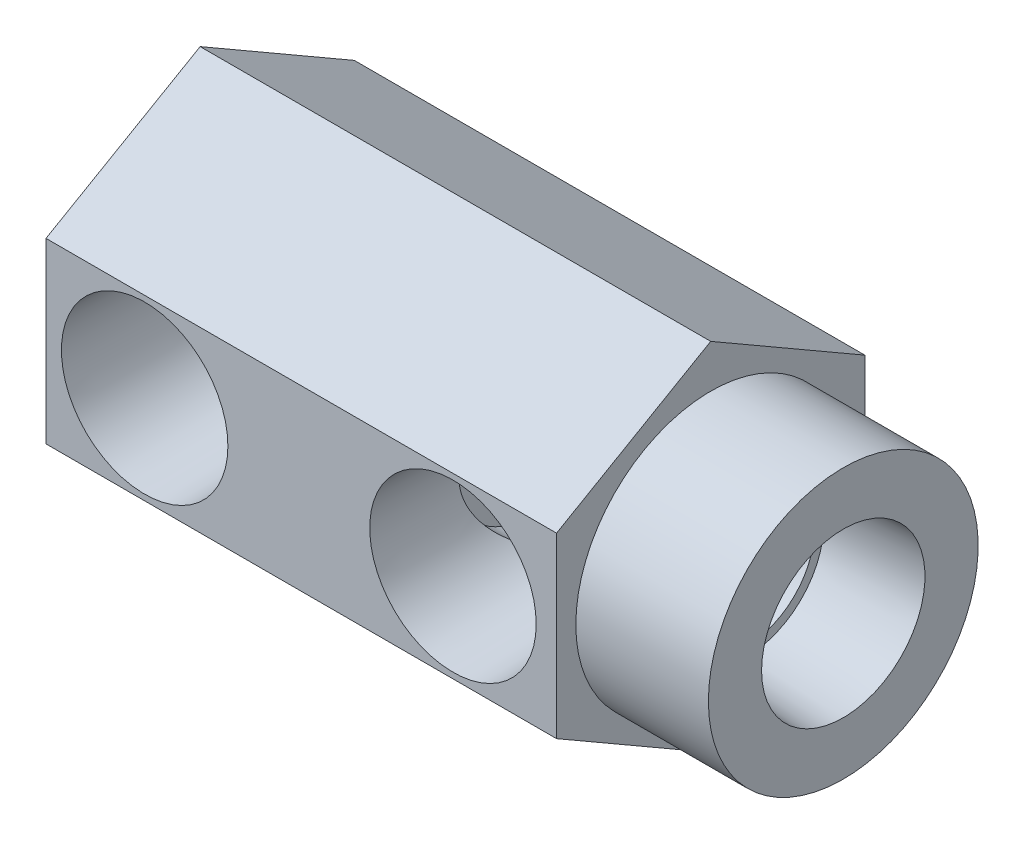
SolidWorks part; units mm, degrees
ref_plane "Front Plane" through (0, 0, 0) normal (0, 0, 1) x (1, 0, 0)
ref_plane "Top Plane" through (0, 0, 0) normal (0, 1, 0) x (1, 0, 0)
ref_plane "Right Plane" through (0, 0, 0) normal (1, 0, 0) x (0, 0, -1)
sketch "Sketch1" plane through (0, 0, 0) normal (1, 0, 0) x (0, 0, -1)
  line L0 (0, 16.1312) -> (0, -16.1312) construction
  line L1 (-12.7, -7.3323) -> (0, -14.6647)
  line L2 (0, -14.6647) -> (12.7, -7.3323)
  line L3 (12.7, -7.3323) -> (12.7, 7.3323)
  line L4 (12.7, 7.3323) -> (0, 14.6647)
  line L5 (0, 14.6647) -> (-12.7, 7.3323)
  line L6 (-12.7, 7.3323) -> (-12.7, -7.3323)
  circle A0 centre (0, 0) radius 12.7 construction
  dimension "D1" = 25.4
extrude "Boss-Extrude1" add sketch "Sketch1" along normal blind 42.0624 separate body
sketch "Sketch2" plane through (0, 0, 0) normal (1, 0, 0) x (0, 0, -1)
  circle A1 centre (0, 0) radius 11.1125
  dimension "D1" = 22.225
extrude "Boss-Extrude2" add sketch "Sketch2" along normal blind 52.9844
hole_wizard "1/4 (0.25) Diameter Hole1" positions "Sketch4" profile "Sketch3" hole size "1/4" standard "Ansi Inch"
sketch "Sketch4" plane through (52.9844, 0, 0) normal (1, 0, 0) x (0, 0, -1)
  circle A0 centre (0, 0) radius 11.1125 construction
  point P0 (0, 0)
sketch "Sketch3" plane through (52.9844, 0, 0) normal (0, 1, 0) x (0, 0, -1)
  line L0 (0, 0) -> (0, 33.6577)
  line L1 (0, 33.6577) -> (3.175, 31.75)
  line L2 (3.175, 31.75) -> (3.175, 0)
  line L5 (3.175, 0) -> (0, 0)
  line L10 (0, 33.6577) -> (-3.175, 31.75) construction
  line L11 (0, -6.35) -> (0, 107.95) construction
  dimension "Hole Dia." = 6.35
  dimension "Hole Depth" = 31.75
  dimension "Drill Angle" = 118
hole_wizard "7/32 (0.21875) Diameter Hole1" positions "Sketch6" profile "Sketch5" hole size "7/32" standard "Ansi Inch"
sketch "Sketch6" plane through (52.9844, 0, 0) normal (1, 0, 0) x (0, 0, -1)
  circle A0 centre (0, 0) radius 11.1125 construction
  point P0 (0, 0)
sketch "Sketch5" plane through (52.9844, 0, 0) normal (0, 1, 0) x (0, 0, -1)
  line L0 (0, 0) -> (0, 46.1193)
  line L1 (0, 46.1193) -> (2.7781, 44.45)
  line L2 (2.7781, 44.45) -> (2.7781, 0)
  line L5 (2.7781, 0) -> (0, 0)
  line L10 (0, 46.1193) -> (-2.7781, 44.45) construction
  line L11 (0, -6.35) -> (0, 107.95) construction
  dimension "Hole Dia." = 5.5562
  dimension "Hole Depth" = 44.45
  dimension "Drill Angle" = 118
hole_wizard "1/4 NPT Tapped Hole1" positions "Sketch8" profile "Sketch7" size "1/4" standard "Ansi Inch"
sketch "Sketch8" plane through (0, 0, 12.7) normal (0, 0, 1) x (1, 0, 0)
  line L0 (13.97, 0) -> (-13.97, 0) construction
  line L1 (0, -13.97) -> (0, 13.97) construction
  point P0 (8.128, 0)
  point P1 (33.528, 0)
  dimension "D1" = 8.128
  dimension "D2" = 25.4
sketch "Sketch7" plane through (8.128, 0, 12.7) normal (1, 0, 0) x (0, -1, 0)
  line L0 (0, 0) -> (0, 20.4111)
  line L1 (5.5626, 17.0688) -> (0, 20.4111)
  line L2 (-5.5626, 17.0688) -> (0, 20.4111) construction
  line L3 (5.5626, 17.0688) -> (5.5626, 10.0203)
  line L4 (5.5626, 10.0203) -> (6.558, 10.0203)
  line L5 (6.558, 10.0203) -> (6.858, 0)
  line L6 (-6.558, 10.0203) -> (-6.858, 0) construction
  line L7 (6.858, 0) -> (0, 0)
  line L8 (0, -6.35) -> (0, 107.95) construction
  line L11 (-5.5626, 10.0203) -> (-6.558, 10.0203) construction
  dimension "Tap Drill Dia." = 11.1252
  dimension "Tap Drill Depth" = 17.0688
  dimension "Thread Dia." = 13.716
  dimension "Thread Angle" = 3.43
  dimension "Thread Depth" = 10.0203
  dimension "Drill Angle" = 118
hole_wizard "1/4 NPT Tapped Hole2" positions "Sketch10" profile "Sketch9" size "1/4" standard "Ansi Inch"
sketch "Sketch10" plane through (0, 0, -12.7) normal (0, 0, -1) x (-1, 0, 0)
  circle A0 centre (-8.128, 0) radius 6.858 construction
  point P0 (-8.128, 0)
sketch "Sketch9" plane through (8.128, 0, -12.7) normal (1, 0, 0) x (0, 1, 0)
  line L0 (0, 0) -> (0, 20.4111)
  line L1 (5.5626, 17.0688) -> (0, 20.4111)
  line L2 (-5.5626, 17.0688) -> (0, 20.4111) construction
  line L3 (5.5626, 17.0688) -> (5.5626, 10.0203)
  line L4 (5.5626, 10.0203) -> (6.558, 10.0203)
  line L5 (6.558, 10.0203) -> (6.858, 0)
  line L6 (-6.558, 10.0203) -> (-6.858, 0) construction
  line L7 (6.858, 0) -> (0, 0)
  line L8 (0, -6.35) -> (0, 107.95) construction
  line L11 (-5.5626, 10.0203) -> (-6.558, 10.0203) construction
  dimension "Tap Drill Dia." = 11.1252
  dimension "Tap Drill Depth" = 17.0688
  dimension "Thread Dia." = 13.716
  dimension "Thread Angle" = 3.43
  dimension "Thread Depth" = 10.0203
  dimension "Drill Angle" = 118
sketch "Sketch11" plane through (0, 0, 0) normal (0, 0, 1) x (1, 0, 0)
  line L3 (52.9844, 6.731) -> (45.0596, 6.3157)
  line L4 (45.0596, 5.5499) -> (45.0596, 6.3157)
  line L5 (45.0596, 5.5499) -> (26.7906, 5.5499)
  line L6 (52.9844, -11.1125) -> (52.9844, 11.1125) construction
  line L7 (52.9844, 0) -> (52.9844, 6.731)
  line L8 (0, 0) -> (50000, 0) construction
  line L9 (0, 7.3323) -> (0, -7.3323) construction
  line L10 (26.7906, 0) -> (26.7906, 5.5499)
  line L11 (26.7906, 0) -> (52.9844, 0)
  point P11 (0, 0)
  dimension "D1" = 26.1937
  dimension "D2" = 13.462
  dimension "D3" = 11.0998
  dimension "D4" = 7.9248
  dimension "D5" = 3
revolve "Cut-Revolve1" cut sketch "Sketch11" angle 360 about L8
